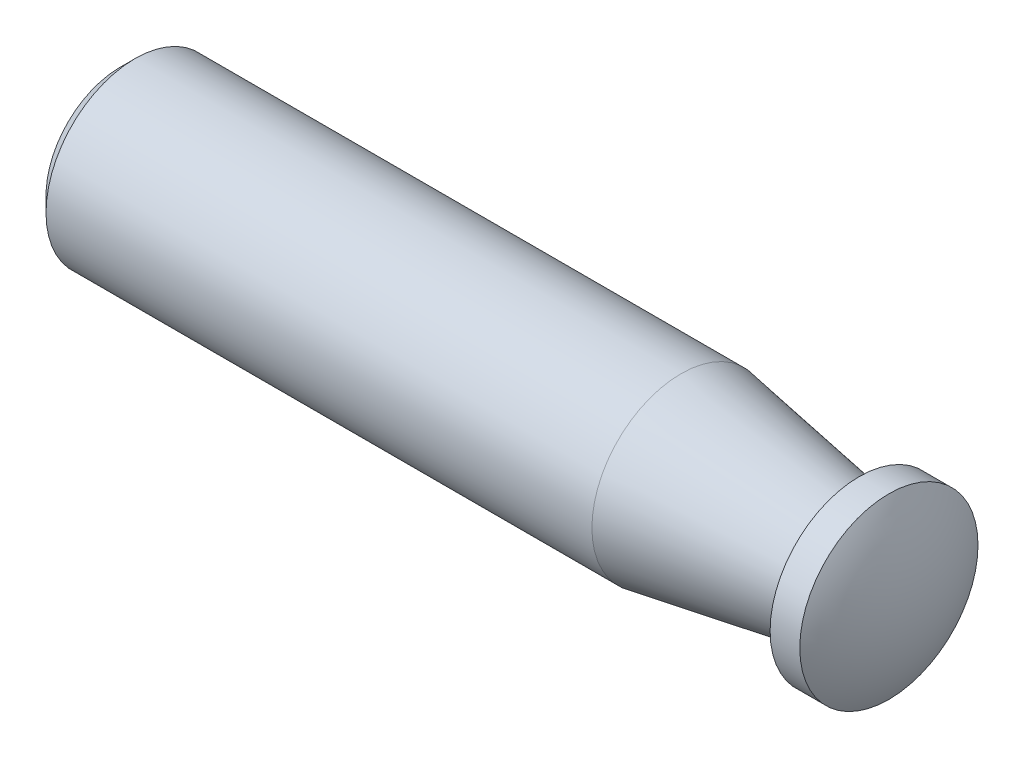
SolidWorks part; units mm, degrees
ref_plane "Face" through (0, 0, 0) normal (0, 0, 1) x (1, 0, 0)
ref_plane "Dessus" through (0, 0, 0) normal (0, 1, 0) x (1, 0, 0)
ref_plane "Droite" through (0, 0, 0) normal (1, 0, 0) x (0, 0, -1)
sketch "Esquisse1" plane through (0, 0, 0) normal (0, 0, 1) x (1, 0, 0)
  line L0 (-25.0744, 0) -> (88.4201, 0) construction
  line L1 (0, 0) -> (0, 3)
  line L2 (0, 3) -> (18.88, 3)
  line L3 (18.88, 11.6499) -> (18.88, -9.9783) construction
  line L4 (24.88, 11.6499) -> (24.88, -9.9783) construction
  line L5 (25.88, 11.6499) -> (25.88, -9.9783) construction
  line L6 (14.3493, 2) -> (35.664, 2) construction
  line L7 (18.88, 3) -> (24.88, 2)
  line L8 (24.88, 2) -> (24.88, 3)
  line L9 (24.88, 3) -> (25.88, 3)
  line L10 (20.88, 6.3586) -> (20.88, -1.4995) construction
  line L11 (0, 0) -> (26.711, 0)
  arc A0 (25.88, 3) -> (26.711, 0) centre (20.88, 0) cw
  dimension "D1" = 3
  dimension "D2" = 18.88
  dimension "D3" = 6
  dimension "D4" = 1
  dimension "D5" = 2
  dimension "D6" = 4
revolve "Base-Révolution" add sketch "Esquisse1" angle 360 about L0
chamfer "Chanfrein1" distance 0.5 angle 45
ref_plane "Plan1" through (15.2135, 0, 0) normal (-1, 0, 0) x (0, 0, 1)
sketch "Esquisse6" plane through (0, 0, 0) normal (0, 0, 1) x (1, 0, 0)
  point P5 (26.7135, 0)
sketch "Esquisse7" plane through (15.2135, 0, 0) normal (-1, 0, 0) x (0, 0, 1)
  line L0 (0, 0) -> (0, 11.0795)
  line L1 (0, 0) -> (16.9054, 0)
  point P0 (0, 0)
